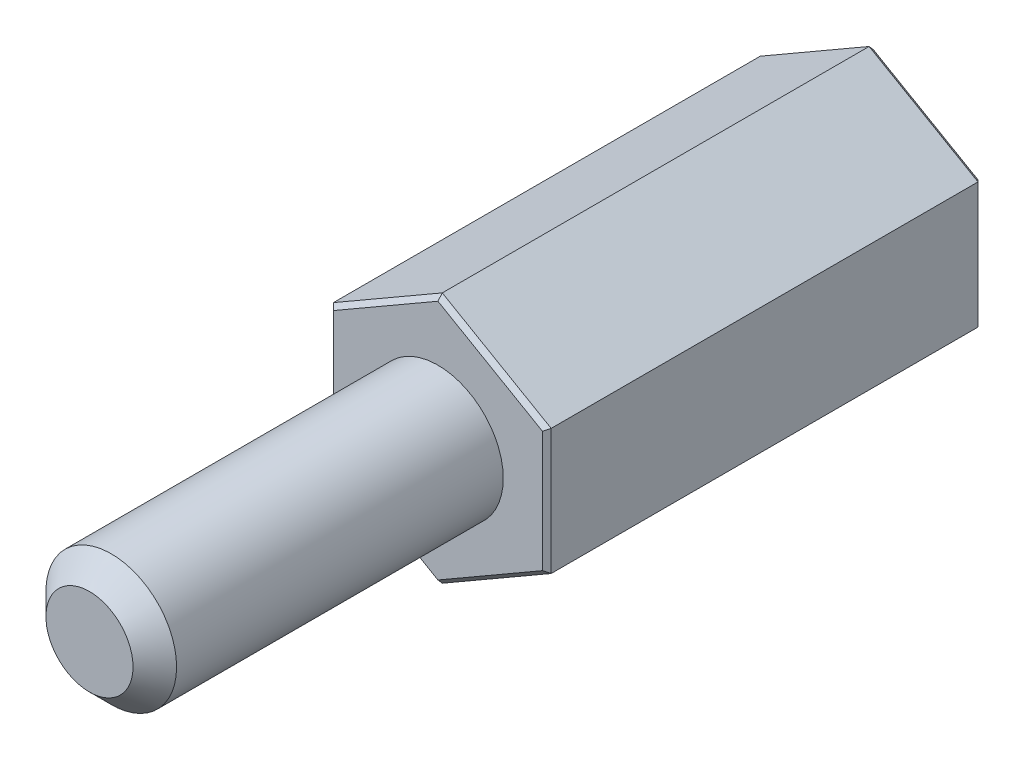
SolidWorks part; units mm, degrees
ref_plane "Přední" through (0, 0, 0) normal (0, 0, 1) x (1, 0, 0)
ref_plane "Horní" through (0, 0, 0) normal (0, 1, 0) x (1, 0, 0)
ref_plane "Pravá" through (0, 0, 0) normal (1, 0, 0) x (0, 0, -1)
sketch "Skica1" plane through (0, 0, 0) normal (0, 0, 1) x (1, 0, 0)
  line L0 (2.5, -1.4434) -> (2.5, 1.4434)
  line L2 (0, 2.5) -> (0, 0) construction
  line L3 (-2.5, -1.4434) -> (-2.5, 1.4434)
  line L4 (0, 0) -> (-1.25, 2.1651) construction
  line L5 (0, 2.8868) -> (-2.5, 1.4434)
  line L6 (0, 2.8868) -> (2.5, 1.4434)
  line L7 (0, 0) -> (-2.5, 0) construction
  line L9 (0, -2.8868) -> (2.5, -1.4434)
  line L10 (0, -2.8868) -> (-2.5, -1.4434)
  circle A0 centre (0, 0) radius 2.5 construction
  dimension "D1" = 5
  dimension "D2" = 30
extrude "Přidat vysunutím1" add sketch "Skica1" along normal blind 10
sketch "Skica2" plane through (0, 0, 10) normal (0, 0, 1) x (1, 0, 0)
  circle A0 centre (0, 0) radius 1.5
  dimension "D1" = 3
extrude "Přidat vysunutím2" add sketch "Skica2" along normal blind 8
chamfer "Zkosení1" distance 0.5 angle 45 1 edges at (1.5, 0, 18)
chamfer "Zkosení2" distance 0.1 angle 45 12 edges at (2.5, 0, 10) (-1.25, 2.1651, 0) (-2.5, 0, 0) (-1.25, -2.1651, 0) (1.25, -2.1651, 0) (1.25, 2.1651, 0) (2.5, 0, 0) (-2.5, 0, 10) (-1.25, -2.1651, 10) (1.25, -2.1651, 10) (-1.25, 2.1651, 10) (1.25, 2.1651, 10)
sketch "Skica3" plane through (0, 0, 0) normal (0, 0, -1) x (-1, 0, 0)
  circle A0 centre (0, 0) radius 1.25
  dimension "D1" = 2.5
extrude "Odebrat vysunutím2" cut sketch "Skica3" against normal blind 7
chamfer "Zkosení5" distance 1.25 angle 45 1 edges at (-1.25, 0, 7)
